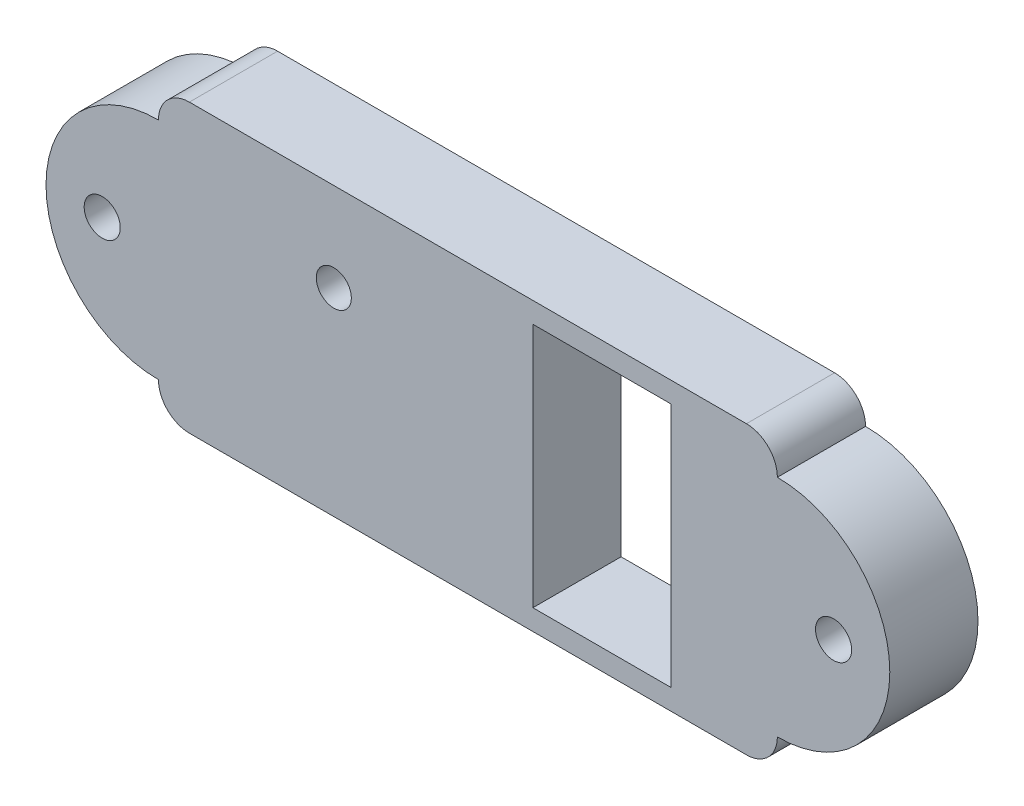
SolidWorks part; units mm, degrees
ref_plane "Plan de face" through (0, 0, 0) normal (0, 0, 1) x (1, 0, 0)
ref_plane "Plan de dessus" through (0, 0, 0) normal (0, 1, 0) x (1, 0, 0)
ref_plane "Plan de droite" through (0, 0, 0) normal (1, 0, 0) x (0, 0, -1)
sketch "Esquisse1" plane through (0, 0, 0) normal (0, 0, 1) x (1, 0, 0)
  line L0 (-13, 0) -> (13, 0) construction
  line L1 (13, 0) -> (13, 6.1) construction
  line L10 (13, 6.1) -> (6.8, 6.1) construction
  line L11 (17.824, 6.1) -> (17.824, 6.6) construction
  line L12 (6.3, 6.6) -> (19.7, 6.6)
  line L13 (6.3, 6.6) -> (6.3, -17.2)
  line L14 (6.3, -17.2) -> (19.7, -17.2)
  line L15 (19.7, 6.6) -> (19.7, -17.2)
  line L16 (19.2, -5.2849) -> (19.7, -5.2849) construction
  line L17 (6.8, -6.83) -> (6.3, -6.83) construction
  line L18 (12.2822, -16.7) -> (12.2822, -17.2) construction
  line L19 (0, 0) -> (0, 8.6) construction
  line L20 (0, 0) -> (-30, 0) construction
  line L21 (-30, 8.6) -> (-30, 5.6) construction
  line L22 (-30, 8.6) -> (-27, 8.6) construction
  line L23 (-27, 8.6) -> (0, 8.6)
  line L25 (27, 8.6) -> (0, 8.6)
  line L29 (-30, 5.6) -> (-30, -16.2)
  line L31 (30, -16.2) -> (30, 5.6)
  line L32 (-30, -5.3) -> (0.6173, -5.3) construction
  line L33 (-27, -19.2) -> (27, -19.2)
  line L34 (13, -17.2) -> (13, -19.2) construction
  line L35 (10.5738, 6.6) -> (10.5738, 8.6) construction
  circle A0 centre (-13, 0) radius 13 construction
  circle A1 centre (13, 0) radius 13 construction
  circle A2 centre (-13, 0) radius 1.7
  arc A7 (-30, 5.6) -> (-27, 8.6) centre (-27, 5.6) ccw construction
  arc A8 (-27, 8.6) -> (-30, 5.6) centre (-27, 5.6) ccw
  arc A9 (27, 8.6) -> (30, 5.6) centre (27, 5.6) cw
  arc A12 (27, -19.2) -> (30, -16.2) centre (27, -16.2) ccw
  arc A13 (-27, -19.2) -> (-30, -16.2) centre (-27, -16.2) cw
  point P42 (30, 0)
  line B0 (6.8, -16.7) -> (6.8, 6.1) construction
  line B1 (6.8, -16.7) -> (19.2, -16.7) construction
  line B2 (19.2, -16.7) -> (19.2, 6.1) construction
  line B3 (19.2, 6.1) -> (6.8, 6.1) construction
  dimension "D2" = 3.4
  dimension "D7" = 3
  dimension "D1" = 6.1
  dimension "D3" = 26
  dimension "D4" = 0.5
  dimension "D5" = 30
  dimension "D8" = 2
sketch_block_instance "Bloc1-1"
sketch_block "Bloc1" parameters "D1"=22.8, "D2"=12.4
extrude "Boss.-Extru.1" add sketch "Esquisse1" along normal blind 8.55 contours A13 L33 A12 L31 A9 L25 L23 A8 L29 A2 L12 L15 L14 L13
sketch "Esquisse4" plane through (0, 0, 0) normal (0, 0, 1) x (1, 0, 0)
  line L0 (6.3, -5.3) -> (19.7, -5.3) construction
  line L1 (6.3, 6.6) -> (6.3, -17.2) construction
  line L2 (19.7, 6.6) -> (19.7, -17.2) construction
  line L3 (13, -5.3) -> (13, 0) construction
  line L4 (13, 0) -> (-13, 0) construction
  line L5 (0, 0) -> (0, 45) construction
  line L6 (-25.4391, 8.6) -> (-25.9752, 6.6732)
  line L7 (-25.9752, 6.6732) -> (2.445, -1.235)
  line L8 (2.445, -1.235) -> (2.9812, 0.6918)
  line L9 (2.9812, 0.6918) -> (-25.4391, 8.6)
  line L10 (-11.7651, 2.7191) -> (0, 45) construction
  line L11 (27, 8.6) -> (-27, 8.6) construction
  point P19 (-23.6521, 6.5691)
  point P20 (-24.7439, 8.6)
  point P23 (-25.4391, 8.6)
  dimension "D1" = 29.5
  dimension "D2" = 2
sketch_block_instance "Bloc2-1"
sketch_block "Bloc2" parameters "D1"=50, "D2"=30, "D3"=0, "D4"=0.5, "D5"=5, "D6"=25
sketch_block_instance "Engrenage-1"
sketch_block "Engrenage" parameters "D1"=3, "D2"=1.2318, "D3"=1, "D4"=1.5
sketch "Esquisse3" plane through (0, 0, 0) normal (0, 0, -1) x (-1, 0, 0)
  line L0 (30, 5.6) -> (30, -16.2) construction
  line L1 (-30, -16.2) -> (-30, 5.6) construction
  line L2 (-30, 5.6) -> (-30, -16.2)
  line L3 (-30, -5.3) -> (-40.9, -5.3) construction
  line L4 (30, 5.6) -> (30, -16.2)
  line L6 (30, -5.3) -> (40.9, -5.3) construction
  arc A0 (-30, 5.6) -> (-30, -16.2) centre (-30, -5.3) ccw
  arc A1 (30, -16.2) -> (30, 5.6) centre (30, -5.3) ccw
  arc A2 (-30, -16.2) -> (-30, 5.6) centre (-30, -5.3) ccw construction
  arc A3 (30, 5.6) -> (30, -16.2) centre (30, -5.3) ccw construction
  circle A4 centre (-35.45, -5.3) radius 1.75
  circle A5 centre (35.45, -5.3) radius 1.75
extrude "Boss.-Extru.3" add sketch "Esquisse3" against normal blind 8.55
ref_plane "Plan1" through (0.3929, 1.412, 0) normal (0.2681, 0.9634, 0) x (-0.9634, 0.2681, 0)
equation "\"D3@Esquisse2\"=\"Diam-M3-screw\""
equation "\"D1@Esquisse3\"=\"Diam-M3-screw\""
